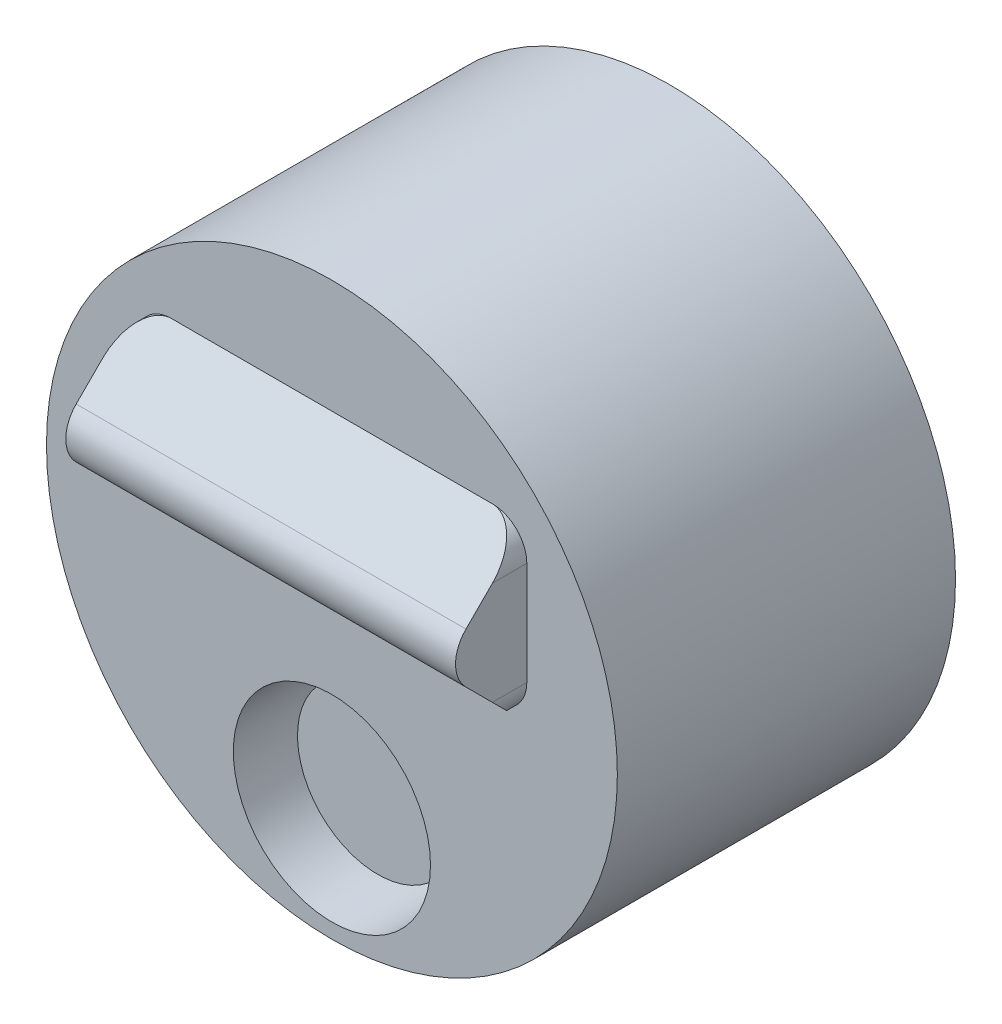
SolidWorks part; units mm, degrees
other "<SLK-8A_W>-<Imported1>"
ref_plane "Front Plane" through (0, 0, 0) normal (0, 0, 1) x (1, 0, 0)
ref_plane "Top Plane" through (0, 0, 0) normal (0, 1, 0) x (1, 0, 0)
ref_plane "Right Plane" through (0, 0, 0) normal (1, 0, 0) x (0, 0, -1)
imported_body "Imported1"
inserted part "SLK-8A_W"
sketch "Sketch1" plane through (0, 0, 0) normal (1, 0, 0) x (0, 0, -1)
  line L0 (3.2004, -2.032) -> (1.016, -2.032)
  line L1 (3.2004, -1.6256) -> (3.2004, -5.9944) construction
  line L2 (1.016, -2.032) -> (1.016, -3.81)
  line L3 (1.016, -3.81) -> (9.5504, -3.81)
  line L4 (9.5504, -3.81) -> (9.5504, -2.7178)
  line L5 (9.5504, -2.7178) -> (3.2004, -2.7178)
  line L6 (3.2004, -2.7178) -> (3.2004, -2.032)
  line L7 (10.8102, -3.81) -> (3.2004, -3.81) construction
  dimension "D1" = 2.1844
  dimension "D2" = 2.1844
  dimension "D3" = 6.35
  dimension "D4" = 3.556
revolve "Revolve1" add sketch "Sketch1" angle 360 about L7
